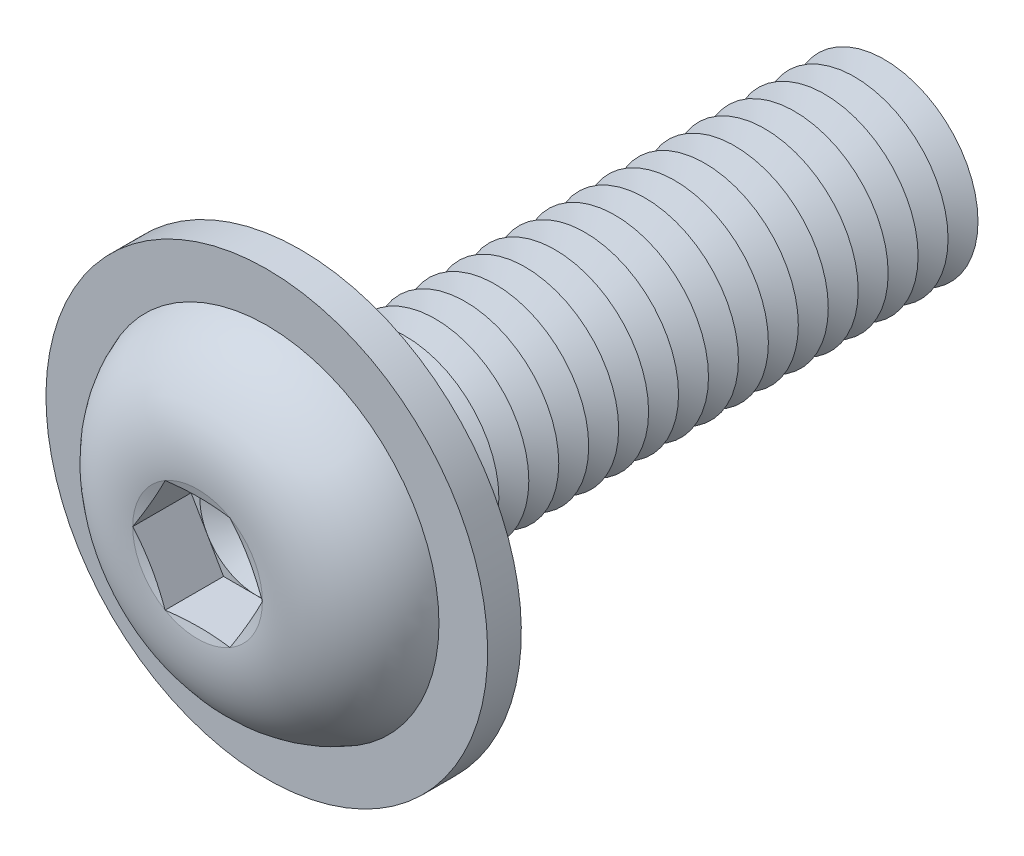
SolidWorks part; units mm, degrees
ref_plane "Front Plane" through (0, 0, 0) normal (0, 0, 1) x (1, 0, 0)
ref_plane "Top Plane" through (0, 0, 0) normal (0, 1, 0) x (1, 0, 0)
ref_plane "Right Plane" through (0, 0, 0) normal (1, 0, 0) x (0, 0, -1)
sketch "Sketch1" plane through (0, 0, 0) normal (1, 0, 0) x (0, 0, -1)
  line L0 (0, 2.5) -> (0, 4.75)
  line L3 (0, 2.5) -> (16, 2.5)
  line L4 (16, 2.5) -> (16, 0)
  line L5 (16, 0) -> (-2.75, 0) construction
  line L6 (-2.75, 0) -> (16, 0)
  line L7 (-2.75, 1.732) -> (-2.75, 0.866) construction
  line L8 (-2.75, 0.866) -> (-2.75, 0)
  line L9 (-2.75, 1.732) -> (-2.5179, 0.866)
  line L10 (-2.5179, 0.866) -> (-2.75, 0.866)
  line L11 (16, 0) -> (22.7481, 0) construction
  line L12 (0, 4.75) -> (-2.75, 4.75) construction
  arc A1 (0, 4.75) -> (-2.75, 1.732) centre (0, 1.9881) ccw
  point P8 (16, 1.25)
  dimension "D1" = 9.5
  dimension "D2" = 5
  dimension "D3" = 2.75
  dimension "D4" = 3.4641
  dimension "D5" = 16
  dimension "D6" = 15
revolve "Revolve1" add sketch "Sketch1" angle 360 about L5
fillet "Fillet1" radius 0.4 1 edges at (-2.5, 0, 0)
sketch "Sketch2" plane through (0, 0, 0) normal (1, 0, 0) x (0, 0, -1)
  line L0 (15.6, 2.5) -> (16.4, 2.5)
  line L1 (16, 2.5) -> (0.4, 2.5) construction
  line L2 (16.4, 2.5) -> (16, 1.8072)
  line L3 (16, -2.5) -> (16, 2.5) construction
  line L4 (16, 1.8072) -> (15.6, 2.5)
  dimension "D1" = 0.8
revolve "Cut-Revolve1" cut sketch "Sketch2" angle 360 about axis through (0, 0, -16) along (0, 0, -1)
pattern_linear "LPattern1" count 20 spacing 0.8 along (0, 0, 1) of "Cut-Revolve1"
sketch "Sketch3" plane through (0, 0, 2.75) normal (0, 0, 1) x (1, 0, 0)
  line L7 (0.866, 1.5) -> (-0.866, 1.5)
  line L8 (-0.866, 1.5) -> (-1.7321, 0)
  line L9 (-1.7321, 0) -> (-0.866, -1.5)
  line L10 (-0.866, -1.5) -> (0.866, -1.5)
  line L11 (0.866, -1.5) -> (1.732, 0)
  line L12 (1.732, 0) -> (0.866, 1.5)
  circle A0 centre (0, 0) radius 1.5 construction
  circle A3 centre (0, 0) radius 1.7321 construction
extrude "Cut-Extrude1" cut sketch "Sketch3" against normal blind 1.56
sketch "Sketch4" plane through (0, 0, 1.19) normal (0, 0, 1) x (1, 0, 0)
  line L1 (0.866, 1.5) -> (-0.866, 1.5) construction
  circle A0 centre (0, 0) radius 1.5
extrude "Cut-Extrude2" cut sketch "Sketch4" against normal through all draft 60
sketch "Sketch5" plane through (0, 0, 0) normal (0, 0, -1) x (-1, 0, 0)
  circle A0 centre (0, 0) radius 5.9
  circle A1 centre (0, 0) radius 2.9
  circle A2 centre (0, 0) radius 2.9 construction
  dimension "D1" = 11.8
extrude "Boss-Extrude1" add sketch "Sketch5" against normal blind 0.9
